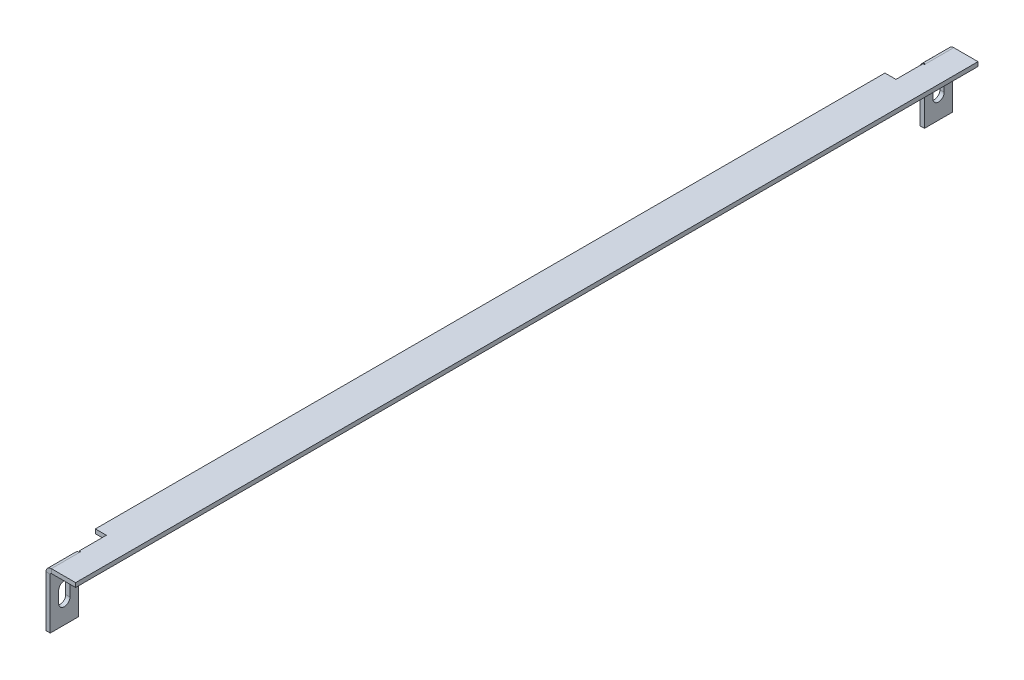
SolidWorks part; units mm, degrees
other "Cut-Extrude20" parameters "Epaisseur"=3
ref_plane "Plan de face" through (0, 0, 0) normal (0, 0, 1) x (1, 0, 0)
ref_plane "Plan de dessus" through (0, 0, 0) normal (0, 1, 0) x (1, 0, 0)
ref_plane "Plan de droite" through (0, 0, 0) normal (1, 0, 0) x (0, 0, -1)
imported_body "Importée1"
sketch "Esquisse1" plane through (0, 0, 320) normal (0, 0, 1) x (1, 0, 0)
  line L0 (30, 0) -> (11.8, 0) construction
  line L1 (12.8, -3.8) -> (12.8, 0) construction
  line L2 (12.8, -3.8) -> (9, -3.8) construction
  line L3 (9, -2.8) -> (9, -3.8)
  line L4 (11.8, 0) -> (12.8, 0)
  arc A0 (12.8, 0) -> (9, -3.8) centre (12.8, -3.8) ccw
  arc A1 (11.8, 0) -> (9, -2.8) centre (11.8, -2.8) ccw construction
  arc A2 (11.8, 0) -> (9, -2.8) centre (11.8, -2.8) ccw
extrude "Enlèv. mat.-Extru.1" cut sketch "Esquisse1" against normal up to vertex
sketch "Esquisse2" plane through (0, 0, -320) normal (0, 0, -1) x (-1, 0, 0)
  line L0 (-12.8, 0) -> (-12.8, -3.8) construction
  line L1 (-12.8, -3.8) -> (-9, -3.8) construction
  line L2 (-11.8, 0) -> (-30, 0) construction
  line L3 (-11.8, 0) -> (-12.8, 0)
  line L4 (-9, -2.8) -> (-9, -3.8)
  arc A0 (-9, -3.8) -> (-12.8, 0) centre (-12.8, -3.8) ccw
  arc A1 (-9, -2.8) -> (-11.8, 0) centre (-11.8, -2.8) ccw construction
  arc A2 (-9, -2.8) -> (-11.8, 0) centre (-11.8, -2.8) ccw
extrude "Enlèv. mat.-Extru.2" cut sketch "Esquisse2" against normal up to vertex
sketch "Esquisse7" plane through (0, 0, 0) normal (0, 1, 0) x (1, 0, 0)
  line L0 (12.8, -300) -> (12.8, -320) construction
  line L1 (11.8, -300) -> (12.8, -300)
  line L2 (11.8, -300) -> (11.8, -299.2)
  line L3 (11.8, -299.2) -> (12.8, -299.2)
  line L4 (12.8, -300) -> (12.8, -299.2)
  line L5 (11.8, -300) -> (12.8, -300) construction
  line L7 (11.8, 300) -> (12.8, 300)
  line L8 (11.8, 300) -> (11.8, 299.2)
  line L9 (11.8, 299.2) -> (12.8, 299.2)
  line L10 (12.8, 300) -> (12.8, 299.2)
  dimension "D1" = 0.8
  dimension "D2" = 0.8
extrude "Enlèv. mat.-Extru.3" cut sketch "Esquisse7" against normal up to next
sheet metal parameters "Tôlerie 2" parameters "D1"=0.8
bend "Pli issu d'un arrondi3" bend radius 0.8 bend angle 90 parameters "D5"=1
flatten bends "Dépliage 2"
sketch "Esquisse-Angle2" plane through (0, 0, 0) normal (0, 1, 0) x (-1, 0, 0)
  line L0 (-11.4648, -300) -> (-11.4648, -320) construction
  line L1 (-11.4648, 320) -> (-11.4648, 300) construction
bend "Pli issu d'un arrondi4" bend radius 0.8 bend angle 90 parameters "D5"=2
process bends "Pliage 2" parameters "D1"=0
sketch "Esquisse-Plate2" plane through (0, 0, 0) normal (0, 1, 0) x (-1, 0, 0)
flat pattern "Etat déplié2"
sketch "Lignes de pliage2" plane through (0, 0, 0) normal (0, 1, 0) x (-1, 0, 0)
  line L0 (-11.4648, 320) -> (-11.4648, 300) construction
  line L1 (-11.4648, -300) -> (-11.4648, -320) construction
  line L2 (-11.4648, 320) -> (-11.4648, 300) construction
  line L3 (-11.4648, -300) -> (-11.4648, -320) construction
sketch3d "Cube de visualisation2" [suppressed]
  line L0 (26.0704, 0, 0) -> (26.0704, -640, 0) construction
  line L1 (-30, 0, 0) -> (-30, -640, 0) construction
  line L2 (26.0704, 0, 0) -> (-30, 0, 0) construction
  line L3 (26.0704, -640, 0) -> (-30, -640, 0) construction
bend of the flat pattern "Dépliage-<Pli issu d'un arrondi3>1"
bend of the flat pattern "Dépliage-<Pli issu d'un arrondi4>1"
